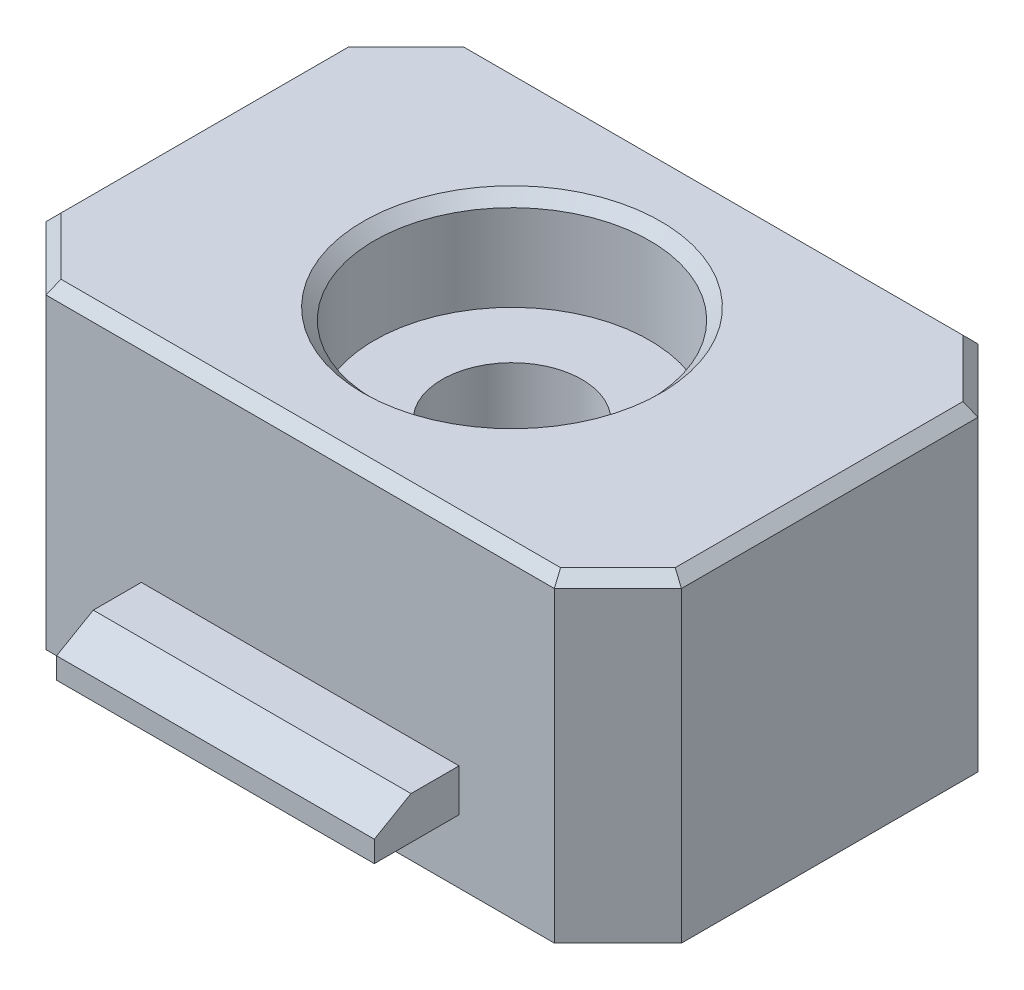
SolidWorks part; units mm, degrees
ref_plane "Front" through (0, 0, 0) normal (0, 0, 1) x (1, 0, 0)
ref_plane "Top" through (0, 0, 0) normal (0, 1, 0) x (1, 0, 0)
ref_plane "Right" through (0, 0, 0) normal (1, 0, 0) x (0, 0, -1)
sketch "Sketch1" plane through (0, 0, 0) normal (0, 1, 0) x (1, 0, 0)
  line L1 (-15, 10) -> (15, 10)
  line L2 (-15, 10) -> (-15, -10)
  line L3 (-15, -10) -> (15, -10)
  line L4 (15, 10) -> (15, -10)
  line L5 (-15, 10) -> (15, -10) construction
  line L6 (-15, -10) -> (15, 10) construction
  point P0 (0, 0)
  dimension "D1" = 20
  dimension "D2" = 30
extrude "Boss-Extrude1" add sketch "Sketch1" along normal blind 15
chamfer "Chamfer1" distance 3 angle 45 4 edges at (-15, 7.5, -10) (15, 7.5, -10) (15, 7.5, 10) (-15, 7.5, 10)
chamfer "Chamfer2" distance 0.5 angle 45 8 edges at (13.5, 15, 8.5) (15, 15, 0) (13.5, 15, -8.5) (0, 15, -10) (-13.5, 15, -8.5) (-15, 15, 0) (-13.5, 15, 8.5) (0, 15, 10)
hole_wizard "CBORE for M6 Pan Head Screw1" positions "Sketch2" profile "Sketch3" counterbore size "M6" standard "ISO"
sketch "Sketch2" plane through (0, 15, 0) normal (0, 1, 0) x (1, 0, 0)
  point P0 (0, 0)
sketch "Sketch3" plane through (0, 15, 0) normal (1, 0, 0) x (0, 0, 1)
  line L0 (0, 0) -> (0, 15)
  line L1 (0, 15) -> (3.3, 15)
  line L3 (3.3, 15) -> (3.3, 4.6)
  line L4 (6.5, 4.6) -> (3.3, 4.6)
  line L5 (6.5, 4.6) -> (6.5, 0.525)
  line L6 (6.5, 0.525) -> (7.025, 0)
  line L7 (7.025, 0) -> (0, 0)
  line L8 (-6.5, 0.525) -> (-7.025, 0) construction
  line L11 (0, -6.35) -> (0, 107.95) construction
  dimension "Thru Hole Dia." = 6.6
  dimension "Thru Hole Depth" = 15
  dimension "C'Bore Dia." = 13
  dimension "C'Bore Depth" = 4.6
  dimension "Near C'Sink Dia." = 14.05
  dimension "Near C'Sink Angle" = 90
ref_plane "Plane1" through (0, 3, 0) normal (0, 1, 0) x (1, 0, 0)
sketch "Sketch4" plane through (0, 3, 0) normal (0, 1, 0) x (1, 0, 0)
  line L0 (12, -10) -> (-12, -10) construction
  line L1 (-7.5, -10) -> (7.5, -10)
  line L2 (-7.5, -10) -> (-7.5, -14)
  line L3 (-7.5, -14) -> (7.5, -14)
  line L4 (7.5, -10) -> (7.5, -14)
  line L5 (0, 0) -> (0, -10) construction
  point P9 (0, 0)
  dimension "D1" = 15
  dimension "D2" = 4
extrude "Boss-Extrude2" add sketch "Sketch4" along normal blind 2
chamfer "Chamfer3" distance 1 angle 60 1 edges at (0, 5, 14)
mirror "Mirror1" about plane through (0, 0, 0) normal (0, 0, 1) of "Chamfer3", "Boss-Extrude2"
